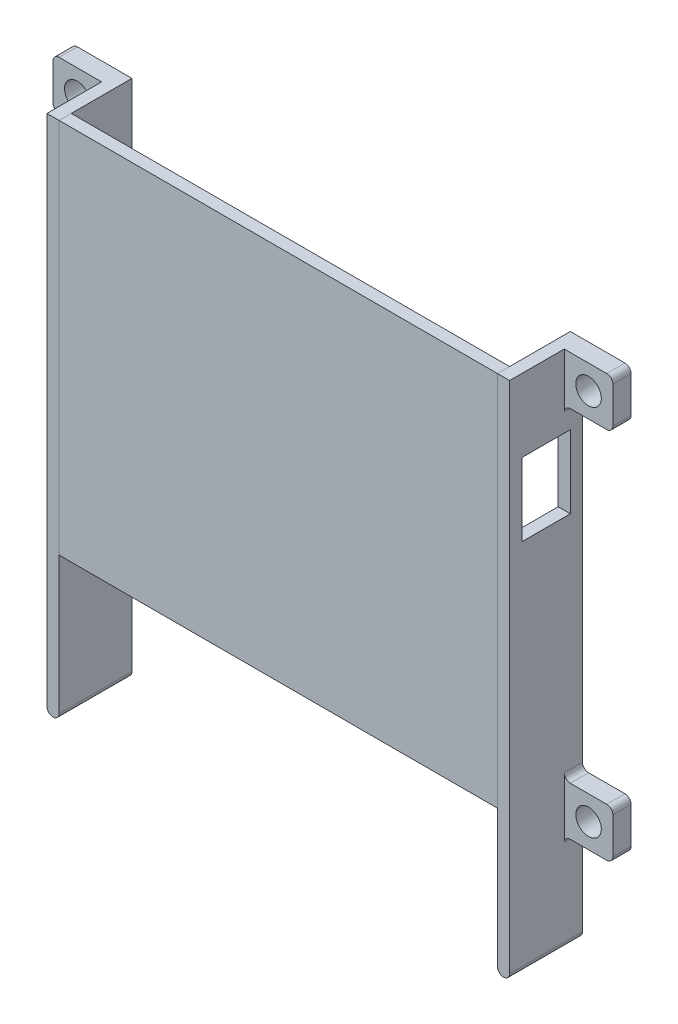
SolidWorks part; units mm, degrees
ref_plane "Front Plane" through (0, 0, 0) normal (0, 0, 1) x (1, 0, 0)
ref_plane "Top Plane" through (0, 0, 0) normal (0, 1, 0) x (1, 0, 0)
ref_plane "Right Plane" through (0, 0, 0) normal (1, 0, 0) x (0, 0, -1)
sketch "Sketch1" plane through (0, 0, 0) normal (0, 0, 1) x (1, 0, 0)
  line L1 (-18.05, 15.5) -> (18.05, 15.5)
  line L2 (-18.05, 15.5) -> (-18.05, -15.5)
  line L3 (-18.05, -15.5) -> (18.05, -15.5)
  line L4 (18.05, 15.5) -> (18.05, -15.5)
  line L5 (-18.05, 15.5) -> (18.05, -15.5) construction
  line L6 (-18.05, -15.5) -> (18.05, 15.5) construction
  point P0 (0, 0)
  dimension "D1" = 36.1
  dimension "D2" = 31
extrude "Boss-Extrude1" add sketch "Sketch1" along normal blind 1
sketch "Sketch2" plane through (0, 0, 1) normal (0, 0, 1) x (1, 0, 0)
  line L0 (0, 15.5) -> (0, -15.5) construction
  line L1 (18.05, 15.5) -> (19.05, 15.5)
  line L2 (18.05, 15.5) -> (18.05, -27.3)
  line L3 (18.05, -27.3) -> (19.05, -27.3)
  line L4 (18.05, -15.5) -> (18.05, 15.5)
  line L5 (18.05, 15.5) -> (-18.05, 15.5)
  line L6 (-18.05, 15.5) -> (-18.05, -15.5)
  line L7 (-18.05, -15.5) -> (18.05, -15.5)
  line L8 (18.05, -15.5) -> (18.05, 15.5)
  line L9 (18.05, 15.5) -> (-18.05, 15.5)
  line L10 (-18.05, 15.5) -> (-18.05, -15.5)
  line L11 (-18.05, -15.5) -> (18.05, -15.5)
  line L12 (19.05, 15.5) -> (19.05, -27.3)
  line L13 (18.05, 15.5) -> (19.05, -27.3) construction
  line L14 (18.05, -27.3) -> (19.05, 15.5) construction
  line L15 (-18.05, -27.3) -> (-19.05, -27.3)
  line L16 (-19.05, 15.5) -> (-19.05, -27.3)
  line L17 (-18.05, 15.5) -> (-19.05, 15.5)
  line L18 (-18.05, 15.5) -> (-18.05, -27.3)
  point P7 (18.55, -5.9)
  dimension "D2" = 1
  dimension "D3" = 42.8
  dimension "D1" = 0
extrude "Boss-Extrude2" add sketch "Sketch2" against normal blind 6 separate body contours L18 L17 L16 L15 M12 | L12 L1 L2 L3 M10
sketch "Sketch3" plane through (-19.05, 0, 0) normal (-1, 0, 0) x (0, 0, 1)
  line L5 (-5, 15.5) -> (-3.5, 15.5)
  line L6 (-5, 15.5) -> (-5, 11.5)
  line L7 (-5, 11.5) -> (-3.5, 11.5)
  line L8 (1, -27.3) -> (1, 15.5)
  line L9 (1, 15.5) -> (-5, 15.5)
  line L10 (-5, 15.5) -> (-5, -27.3)
  line L11 (-5, -27.3) -> (1, -27.3)
  line L12 (1, -27.3) -> (1, 15.5)
  line L13 (1, 15.5) -> (-5, 15.5)
  line L14 (-5, 15.5) -> (-5, -27.3)
  line L15 (-5, -27.3) -> (1, -27.3)
  line L16 (-3.5, 15.5) -> (-3.5, 11.5)
  line L17 (-5, 15.5) -> (-3.5, 11.5) construction
  line L18 (-5, 11.5) -> (-3.5, 15.5) construction
  point P5 (-4.25, 13.5)
  dimension "D2" = 1.5
  dimension "D3" = 4
  dimension "D1" = 0
extrude "Boss-Extrude3" add sketch "Sketch3" along normal blind 4 contours L16 L7 M8 M9
sketch "Sketch4" plane through (0, 0, -3.5) normal (0, 0, 1) x (1, 0, 0)
  line L0 (-21.05, 13.5) -> (-21.05, -17.2198) construction
  line L1 (-23.05, 15.5) -> (-19.05, 15.5) construction
  line L2 (-23.05, 15.5) -> (-23.05, 11.5) construction
  line L3 (-23.05, 11.5) -> (-19.05, 11.5) construction
  line L4 (-19.05, 11.5) -> (-19.05, 15.5)
  line L5 (-19.05, 15.5) -> (-23.05, 15.5)
  line L6 (-23.05, 15.5) -> (-23.05, 11.5)
  line L7 (-23.05, 11.5) -> (-19.05, 11.5)
  line L8 (-19.05, 11.5) -> (-19.05, 15.5)
  line L9 (-19.05, 15.5) -> (-23.05, 15.5)
  line L10 (-23.05, 15.5) -> (-23.05, 11.5)
  line L11 (-23.05, 11.5) -> (-19.05, 11.5)
  line L12 (-19.05, 15.5) -> (-19.05, 11.5) construction
  line L13 (-23.05, 15.5) -> (-19.05, 11.5) construction
  line L14 (-23.05, 11.5) -> (-19.05, 15.5) construction
  circle A0 centre (-21.05, 13.5) radius 1.05
  point P4 (-21.05, 13.5)
  dimension "D2" = 2.1
  dimension "D3" = 30.7198
  dimension "D1" = 0
extrude "Cut-Extrude1" cut sketch "Sketch4" against normal blind 4 contours A0
sketch "Sketch5" plane through (0, 0, -3.5) normal (0, 0, 1) x (1, 0, 0)
  line L0 (-21.05, 13.5) -> (-21.05, -17.2198) construction
  line L1 (-21.05, -17.2198) -> (-19.05, -17.2198) construction
  line L3 (-23.05, -15.2198) -> (-19.05, -15.2198)
  line L4 (-19.05, 11.5) -> (-19.05, 15.5)
  line L5 (-19.05, 15.5) -> (-23.05, 15.5)
  line L6 (-23.05, 15.5) -> (-23.05, 11.5)
  line L7 (-23.05, 11.5) -> (-19.05, 11.5)
  line L8 (-19.05, 11.5) -> (-19.05, 15.5)
  line L9 (-19.05, 15.5) -> (-23.05, 15.5)
  line L10 (-23.05, 15.5) -> (-23.05, 11.5)
  line L11 (-23.05, 11.5) -> (-19.05, 11.5)
  line L12 (-23.05, -15.2198) -> (-23.05, -19.2198)
  line L13 (-23.05, -19.2198) -> (-19.05, -19.2198)
  line L14 (-19.05, -15.2198) -> (-19.05, -19.2198)
  line L15 (-23.05, -15.2198) -> (-19.05, -19.2198) construction
  line L16 (-23.05, -19.2198) -> (-19.05, -15.2198) construction
  circle A0 centre (-21.05, 13.5) radius 1.05 construction
  circle A1 centre (-21.05, 13.5) radius 1.05
  circle A2 centre (-21.05, -17.2198) radius 1.05
  dimension "D3" = 4
  dimension "D2" = 30.7198
  dimension "D4" = 4
  dimension "D1" = 0
extrude "Boss-Extrude4" add sketch "Sketch5" against normal up to vertex contours L14 L3 L12 L13 A2
sketch "Sketch6" plane through (0, 0, -5) normal (0, 0, -1) x (-1, 0, 0)
  line L0 (-19.05, 15.5) -> (-19.05, -27.3) construction
  line L1 (-19.05, -27.3) -> (-18.05, -27.3) construction
  line L2 (-18.05, -27.3) -> (-18.05, 15.5) construction
  line L3 (-18.05, 15.5) -> (-19.05, 15.5) construction
  line L4 (-18.05, 15.5) -> (-18.05, -15.5) construction
  line L5 (-18.05, -15.5) -> (18.05, -15.5) construction
  line L6 (18.05, -15.5) -> (18.05, 15.5) construction
  line L7 (18.05, 15.5) -> (-18.05, 15.5) construction
  line L8 (18.05, 15.5) -> (18.05, -27.3) construction
  line L9 (18.05, -27.3) -> (19.05, -27.3) construction
  line L10 (19.05, -27.3) -> (19.05, -19.2198) construction
  line L11 (19.05, -19.2198) -> (23.05, -19.2198) construction
  line L12 (23.05, -19.2198) -> (23.05, -15.2198) construction
  line L13 (23.05, -15.2198) -> (19.05, -15.2198) construction
  line L14 (19.05, -15.2198) -> (19.05, 11.5) construction
  line L15 (19.05, 11.5) -> (23.05, 11.5) construction
  line L16 (23.05, 11.5) -> (23.05, 15.5) construction
  line L17 (23.05, 15.5) -> (18.05, 15.5) construction
  line L18 (-19.05, 15.5) -> (-19.05, -27.3)
  line L19 (-19.05, -27.3) -> (-18.05, -27.3)
  line L20 (-18.05, -27.3) -> (-18.05, 15.5)
  line L21 (-18.05, 15.5) -> (-19.05, 15.5)
  line L22 (-18.05, 15.5) -> (-18.05, -15.5)
  line L23 (-18.05, -15.5) -> (18.05, -15.5)
  line L24 (18.05, -15.5) -> (18.05, 15.5)
  line L25 (18.05, 15.5) -> (-18.05, 15.5)
  line L26 (18.05, 15.5) -> (18.05, -27.3)
  line L27 (18.05, -27.3) -> (19.05, -27.3)
  line L28 (19.05, -27.3) -> (19.05, -19.2198)
  line L29 (19.05, -19.2198) -> (23.05, -19.2198)
  line L30 (23.05, -19.2198) -> (23.05, -15.2198)
  line L31 (23.05, -15.2198) -> (19.05, -15.2198)
  line L32 (19.05, -15.2198) -> (19.05, 11.5)
  line L33 (19.05, 11.5) -> (23.05, 11.5)
  line L34 (23.05, 11.5) -> (23.05, 15.5)
  line L35 (23.05, 15.5) -> (18.05, 15.5)
  line L36 (0, 15.5) -> (0, -15.5) construction
  line L38 (-23.05, 11.5) -> (-19.05, 11.5)
  line L39 (-23.05, 11.5) -> (-23.05, 15.5)
  line L40 (-23.05, 15.5) -> (-19.05, 15.5)
  line L41 (-19.05, 11.5) -> (-19.05, 15.5)
  line L42 (-23.05, 11.5) -> (-19.05, 15.5) construction
  line L43 (-23.05, 15.5) -> (-19.05, 11.5) construction
  line L44 (-23.05, -19.2198) -> (-19.05, -19.2198)
  line L45 (-23.05, -19.2198) -> (-23.05, -15.2198)
  line L46 (-23.05, -15.2198) -> (-19.05, -15.2198)
  line L47 (-19.05, -19.2198) -> (-19.05, -15.2198)
  line L48 (-23.05, -19.2198) -> (-19.05, -15.2198) construction
  line L49 (-23.05, -15.2198) -> (-19.05, -19.2198) construction
  circle A0 centre (21.05, -17.2198) radius 1.05 construction
  circle A1 centre (21.05, 13.5) radius 1.05 construction
  circle A2 centre (21.05, -17.2198) radius 1.05
  circle A3 centre (21.05, 13.5) radius 1.05
  circle A4 centre (-21.05, -17.2198) radius 1.05
  circle A5 centre (-21.05, 13.5) radius 1.05
  dimension "D1" = 4
extrude "Boss-Extrude5" add sketch "Sketch6" against normal blind 1.5 contours L40 L39 L38 L18 A5 | L46 L45 L44 L18 A4
sketch "Sketch7" plane through (-19.05, 0, 0) normal (-1, 0, 0) x (0, 0, 1)
  line L1 (-4, 9.5) -> (0, 9.5)
  line L2 (-4, 9.5) -> (-4, 3.5)
  line L3 (-4, 3.5) -> (0, 3.5)
  line L4 (0, 9.5) -> (0, 3.5)
  line L5 (-4, 9.5) -> (0, 3.5) construction
  line L6 (-4, 3.5) -> (0, 9.5) construction
  line L10 (-3.5, -19.2198) -> (-5, -19.2198)
  line L11 (-5, -19.2198) -> (-5, -27.3)
  line L12 (-5, -27.3) -> (1, -27.3)
  line L13 (1, -27.3) -> (1, 15.5)
  line L14 (1, 15.5) -> (-3.5, 15.5)
  line L15 (-3.5, 15.5) -> (-3.5, 11.5)
  line L16 (-3.5, 11.5) -> (-5, 11.5)
  line L17 (-5, 11.5) -> (-5, -15.2198)
  line L18 (-5, -15.2198) -> (-3.5, -15.2198)
  line L19 (-3.5, -15.2198) -> (-3.5, -19.2198)
  line L20 (-3.5, -19.2198) -> (-5, -19.2198)
  line L21 (-5, -19.2198) -> (-5, -27.3)
  line L22 (-5, -27.3) -> (1, -27.3)
  line L23 (1, -27.3) -> (1, 15.5)
  line L24 (1, 15.5) -> (-3.5, 15.5)
  line L25 (-3.5, 15.5) -> (-3.5, 11.5)
  line L26 (-3.5, 11.5) -> (-5, 11.5)
  line L27 (-5, 11.5) -> (-5, -15.2198)
  line L28 (-5, -15.2198) -> (-3.5, -15.2198)
  line L29 (-3.5, -15.2198) -> (-3.5, -19.2198)
  point P10 (-2, 6.5)
  dimension "D2" = 6
  dimension "D3" = 4
  dimension "D4" = 1
  dimension "D5" = 6
  dimension "D1" = 0
extrude "Cut-Extrude2" cut sketch "Sketch7" against normal through all contours L2 L1 L4 L3
fillet "Fillet1" radius 0.5 9 edges at (-19.05, -27.3, -2) (-18.05, -27.3, -2) (-19.05, -19.2198, -4.25) (-23.05, -15.2198, -4.25) (-23.05, -19.2198, -4.25) (-19.05, 11.5, -4.25) (-23.05, 11.5, -4.25) (-23.05, 15.5, -4.25) (-19.05, -15.2198, -4.25)
fillet "Fillet2" radius 0.5 9 edges at (18.05, -27.3, -2) (19.05, -27.3, -2) (19.05, -15.2198, -4.25) (23.05, -15.2198, -4.25) (19.05, -19.2198, -4.25) (23.05, -19.2198, -4.25) (19.05, 11.5, -4.25) (23.05, 15.5, -4.25) (23.05, 11.5, -4.25)
